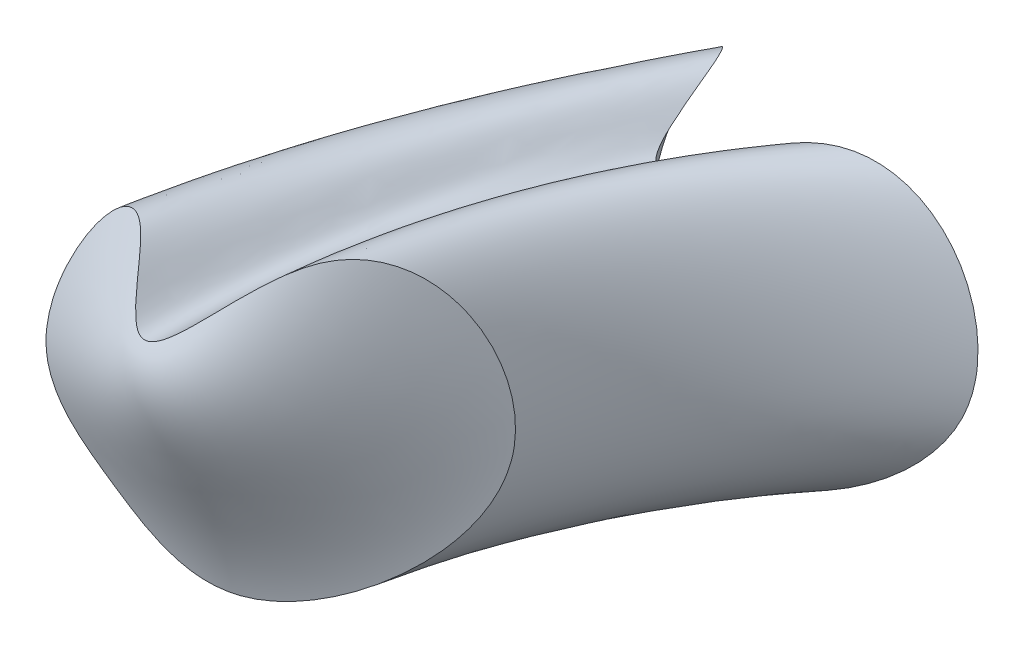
SolidWorks part; units mm, degrees
ref_plane "Vorne" through (0, 0, 0) normal (0, 0, 1) x (1, 0, 0)
ref_plane "Oben" through (0, 0, 0) normal (0, 1, 0) x (1, 0, 0)
ref_plane "Rechts" through (0, 0, 0) normal (1, 0, 0) x (0, 0, -1)
sketch3d "3D-Skizze1"
  spline_without_curve S0
sketch "Skizze2" plane through (0, 0, 0) normal (0, 0, 1) x (1, 0, 0)
  line L0 (260.5856, 142.0673) -> (214.4667, -51.8435) construction
surface "Oberflächenausfüllung2" sketch "3D-Skizze1"
move or copy body "Körper-Verschieben/Kopieren2" bodies to move or copy 103
sketch "Skizze4" plane through (0, 0, 0) normal (0, 1, 0) x (1, 0, 0)
  line L2 (260.5856, 0) -> (214.4667, 0) construction
  arc A0 (37.2062, 38.2073) -> (80.3806, 128.1402) centre (232.0453, 0) cw
surface "Oberfläche-Ausformung1"
surface "Oberfläche-Zusammenfügen1"
